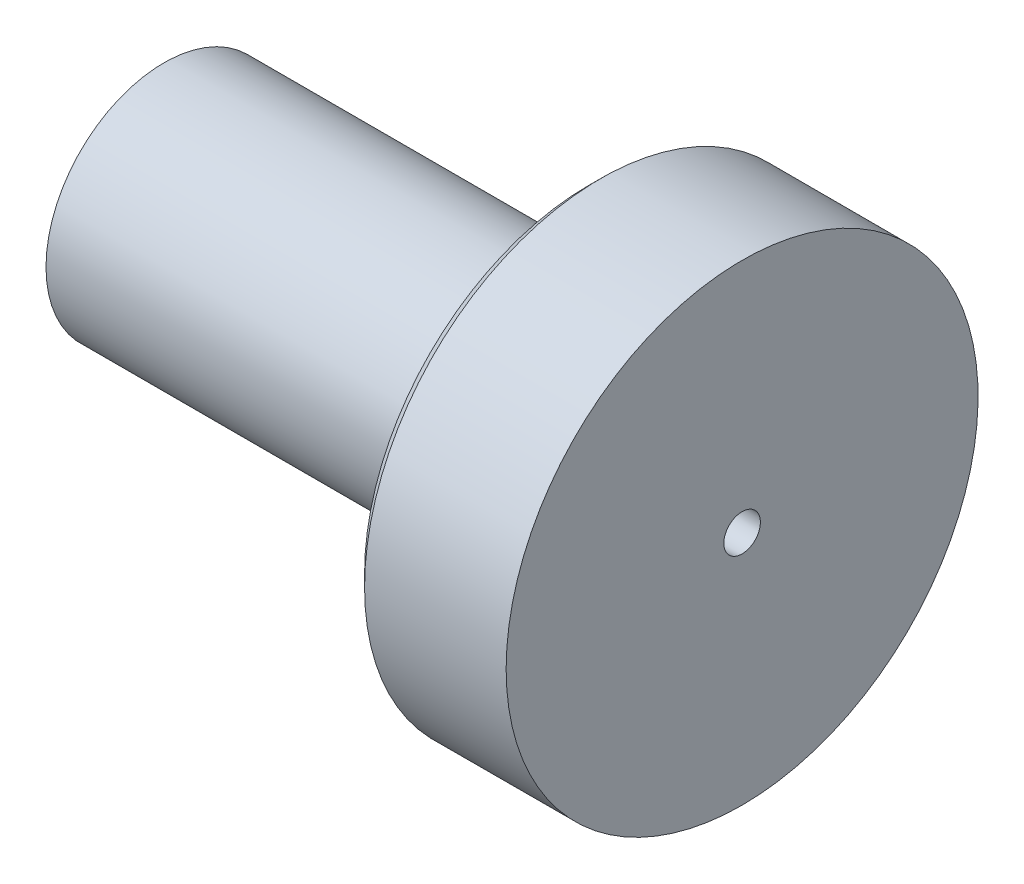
SolidWorks part; units mm, degrees
ref_plane "Face" through (0, 0, 0) normal (0, 0, 1) x (1, 0, 0)
ref_plane "Dessus" through (0, 0, 0) normal (0, 1, 0) x (1, 0, 0)
ref_plane "Droite" through (0, 0, 0) normal (1, 0, 0) x (0, 0, -1)
imported_body "Importée1"
sketch "Esquisse1" plane through (0, 0, 0) normal (0, 0, 1) x (1, 0, 0)
  line L0 (53, 20) -> (53, -20)
  line L1 (54, 20) -> (41, 20) construction
  line L2 (55, -19) -> (55, 19) construction
  line L3 (41, -20) -> (54, -20) construction
  dimension "D1" = 2
extrude "Enlèv. de mat.-Extru.-Mince1" cut sketch "Esquisse1" against normal through all and the other way through all thin
sketch "Esquisse2" plane through (0, 0, 0) normal (0, 0, 1) x (1, 0, 0)
  line L0 (4, 10) -> (4, -10)
  line L1 (36, 10) -> (0, 10) construction
  line L2 (0, 10) -> (0, -10) construction
  line L3 (0, -10) -> (36, -10) construction
  dimension "D1" = 4
extrude "Enlèv. de mat.-Extru.-Mince2" cut sketch "Esquisse2" against normal through all and the other way through all thin
